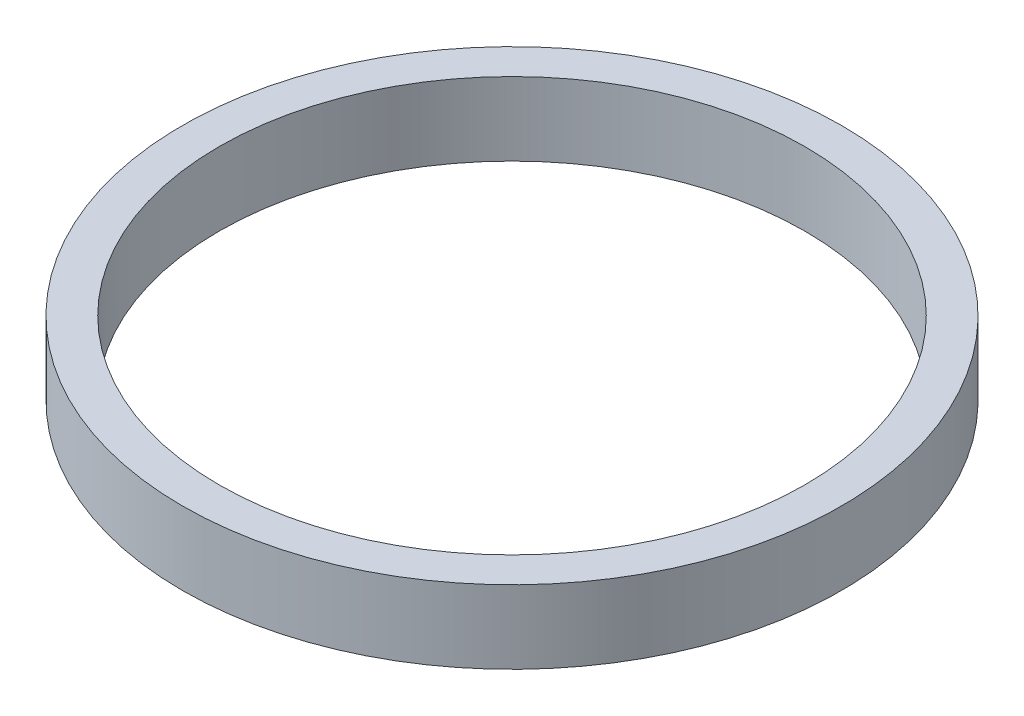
SolidWorks part; units mm, degrees
ref_plane "Front Plane" through (0, 0, 0) normal (0, 0, 1) x (1, 0, 0)
ref_plane "Top Plane" through (0, 0, 0) normal (0, 1, 0) x (1, 0, 0)
ref_plane "Right Plane" through (0, 0, 0) normal (1, 0, 0) x (0, 0, -1)
sketch "Sketch1" plane through (0, 0, 0) normal (0, 1, 0) x (1, 0, 0)
  circle A0 centre (0, 0) radius 40
  circle A1 centre (0, 0) radius 45
  dimension "D1" = 80
  dimension "D2" = 90
extrude "Boss-Extrude1" add sketch "Sketch1" along normal blind 10
